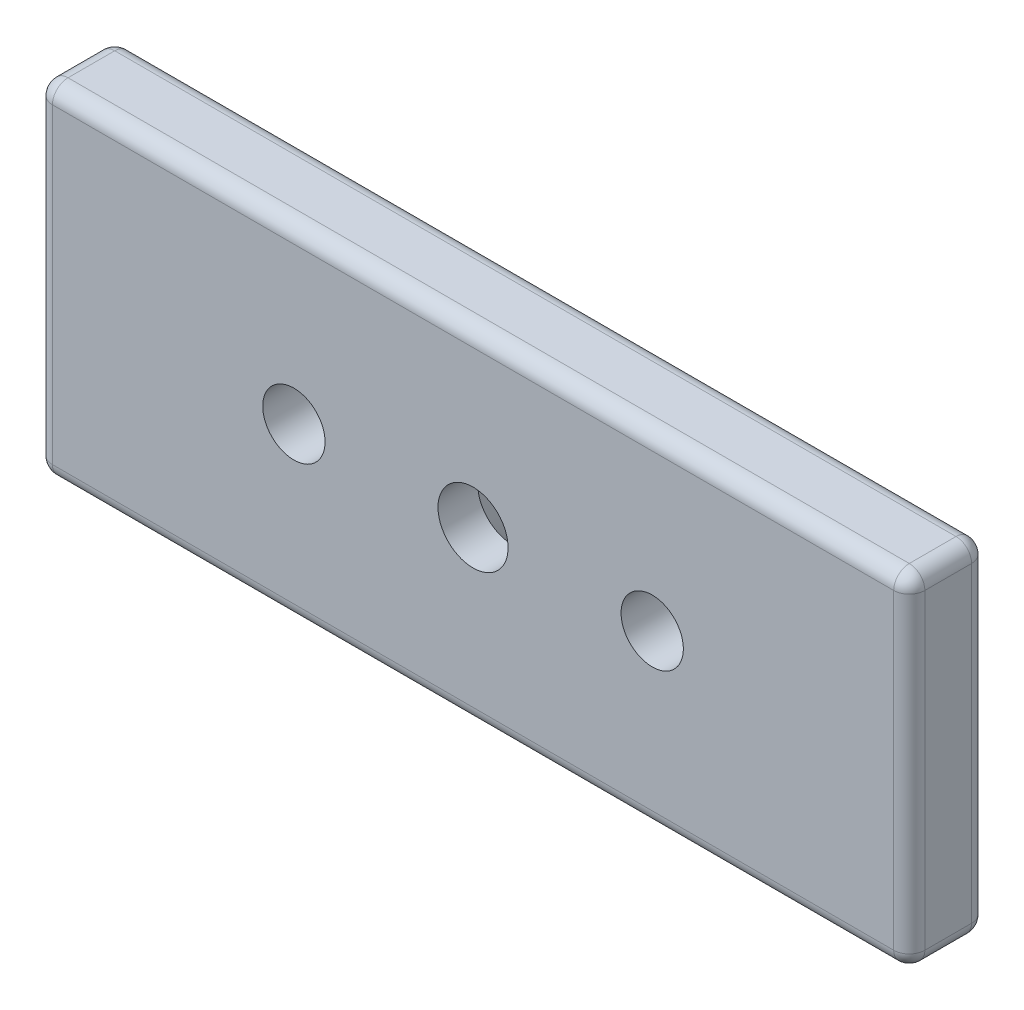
SolidWorks part; units mm, degrees
ref_plane "Front Plane" through (0, 0, 0) normal (0, 0, 1) x (1, 0, 0)
ref_plane "Top Plane" through (0, 0, 0) normal (0, 1, 0) x (1, 0, 0)
ref_plane "Right Plane" through (0, 0, 0) normal (1, 0, 0) x (0, 0, -1)
sketch "Sketch-Base " plane through (0, 0, 0) normal (0, 0, 1) x (1, 0, 0)
  line L1 (0, 0) -> (56, 0)
  line L2 (0, 0) -> (0, 22)
  line L3 (0, 22) -> (56, 22)
  line L4 (56, 0) -> (56, 22)
  dimension "D1" = 56
  dimension "D2" = 22
extrude "Base-Extrude " add sketch "Sketch-Base " against normal blind 5
sketch "Sketch2" plane through (0, 0, 0) normal (0, 0, 1) x (1, 0, 0)
  line L0 (0, 0) -> (56, 0) construction
  line L1 (0, 22) -> (0, 0) construction
  circle A0 centre (16.5, 11) radius 2
  circle A1 centre (39.5, 11) radius 2
  dimension "D1" = 4
  dimension "D2" = 11
  dimension "D3" = 16.5
  dimension "D4" = 39.5
extrude "Mounting Holes " cut sketch "Sketch2" against normal through all
fillet "Small Edge Fillet" radius 1 4 edges at (56, 0, -2.5) (56, 22, -2.5) (0, 22, -2.5) (0, 0, -2.5)
fillet "Front-Back Edge Fillet" radius 1 16 edges at (55.7071, 21.7071, -5) (56, 11, -5) (55.7071, 0.2929, -5) (28, 0, -5) (0.2929, 0.2929, -5) (0, 11, -5) (0.2929, 21.7071, -5) (55.7071, 21.7071, 0) (56, 11, 0) (55.7071, 0.2929, 0) (28, 0, 0) (0.2929, 0.2929, 0) (0, 11, 0) (0.2929, 21.7071, 0) (28, 22, -5) (28, 22, 0)
hole_wizard "CSK for M4 Flat Head Machine Screw1" positions "Sketch4" profile "Sketch3" countersink size "M4" standard "Ansi Metric"
sketch "Sketch4" plane through (0, 0, -5) normal (0, 0, -1) x (-1, 0, 0)
  line L0 (0, 21) -> (0, 1) construction
  line L1 (-1, 0) -> (-55, 0) construction
  point P0 (-28, 11)
  dimension "D1" = 28
  dimension "D2" = 11
sketch "Sketch3" plane through (28, 11, -5) normal (1, 0, 0) x (0, 1, 0)
  line L0 (0, 0) -> (0, 5)
  line L1 (0, 5) -> (2.25, 5)
  line L2 (2.25, 5) -> (2.25, 2.45)
  line L3 (2.25, 2.45) -> (4.7, 0)
  line L5 (4.7, 0) -> (0, 0)
  line L6 (-2.25, 2.45) -> (-4.7, 0) construction
  line L11 (0, -6.35) -> (0, 107.95) construction
  dimension "Thru Hole Dia." = 4.5
  dimension "Thru Hole Depth" = 5
  dimension "Near C'Sink Dia." = 9.4
  dimension "Near C'Sink Angle" = 90
